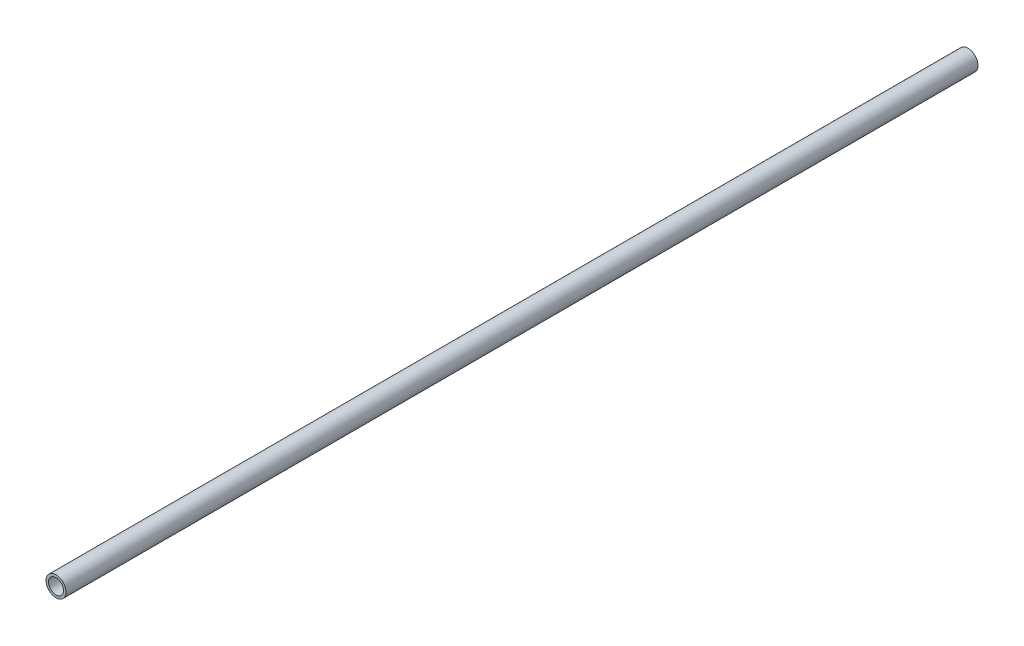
SolidWorks part; units mm, degrees
ref_plane "Face" through (0, 0, 0) normal (0, 0, 1) x (1, 0, 0)
ref_plane "Dessus" through (0, 0, 0) normal (0, 1, 0) x (1, 0, 0)
ref_plane "Droite" through (0, 0, 0) normal (1, 0, 0) x (0, 0, -1)
sketch "Esquisse1" plane through (0, 0, 0) normal (0, 0, 1) x (1, 0, 0)
  circle A0 centre (0, 0) radius 4
  circle A1 centre (0, 0) radius 3
  dimension "D1" = 6
  dimension "D2" = 8
extrude "Extrusion1" add sketch "Esquisse1" along normal blind 365
